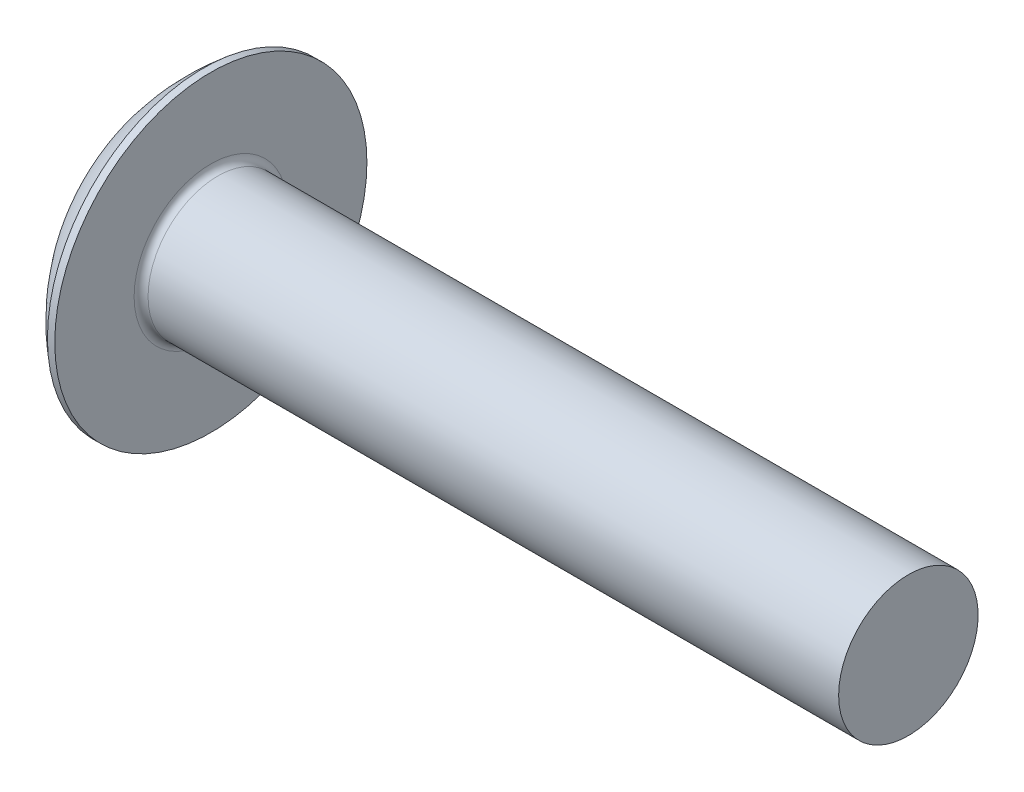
SolidWorks part; units mm, degrees
ref_plane "Front Plane" through (0, 0, 0) normal (0, 0, 1) x (1, 0, 0)
ref_plane "Top Plane" through (0, 0, 0) normal (0, 1, 0) x (1, 0, 0)
ref_plane "Right Plane" through (0, 0, 0) normal (1, 0, 0) x (0, 0, -1)
sketch "BodySke" plane through (0, 0, 0) normal (0, 0, 1) x (1, 0, 0)
  line L0 (0, 0) -> (120.5141, 0) construction
  line L1 (0, 0) -> (0, 50.5629) construction
  line L2 (4.7, 8.95) -> (4.7, 4)
  line L3 (4.7, 4) -> (44.7, 4)
  line L4 (44.7, 4) -> (44.7, 0)
  line L5 (0, 0) -> (44.7, 0)
  line L6 (4.7, 8.95) -> (4.2787, 8.95)
  line L7 (5.95, 10.4217) -> (5.95, -3.1786) construction
  line L8 (7.2, 9.5609) -> (7.2, -6.7938) construction
  arc A0 (0, 0) -> (4.2787, 8.95) centre (11.5, 0) cw
  point P14 (44.7, 3.3095)
  dimension "Head_radius" = 11.5
  dimension "Diameter" = 8
  dimension "Head_height" = 4.7
  dimension "Length" = 40
  dimension "Head_dia" = 17.9
  dimension "Advance" = 1.25
  dimension "Thread_minor" = 6.619
  dimension "Thread_runout" = 2.5
revolve "BaseBody" add sketch "BodySke" angle 360 about L0
fillet "Fillet1" radius 0.4 1 edges at (4.7, 0, 4)
sketch "SlotSke" plane through (0, 0, 0) normal (1, 0, 0) x (0, 0, -1)
  line L1 (8.95, 1.155) -> (-8.95, 1.155)
  line L2 (8.95, 1.155) -> (8.95, -1.155)
  line L3 (8.95, -1.155) -> (-8.95, -1.155)
  line L4 (-8.95, 1.155) -> (-8.95, -1.155)
  dimension "D1" = 17.9
  dimension "D2" = 8.95
  dimension "Slot_width" = 2.31
  dimension "D4" = 1.155
extrude "Slot" cut sketch "SlotSke" along normal blind 2.17
sketch "ThdSchSke" plane through (0, 0, 0) normal (0, 0, 1) x (1, 0, 0)
  line L0 (0, 0) -> (54.7976, 0) construction
  line L1 (44.3013, 4.7973) -> (44.3013, 4)
  line L2 (44.3013, 4.7973) -> (45.0987, 4.7973)
  line L3 (45.0987, 4.7973) -> (45.0987, 4)
  line L4 (45.0987, 4) -> (44.7, 3.3095)
  line L5 (44.7, 3.3095) -> (44.3013, 4)
  line L6 (4.7, 4) -> (44.7, 4) construction
revolve "ThreadSchematic" [suppressed] cut sketch "ThdSchSke" angle 360 about L0
pattern_linear "ThdSchPat" [suppressed] count 31 along (1, 0, 0)
equation "\"Thread_minor@ThreadCosmetic\" = \"Thread_minor@BodySke\""
equation "\"D1@SlotSke\" = \"Head_dia@BodySke\""
equation "\"D2@SlotSke\" = \"D1@SlotSke\" / 2"
equation "\"D4@SlotSke\" = \"Slot_width@SlotSke\" / 2"
equation "\"Advance@ThdSchPat\" = \"Advance@BodySke\""
equation "\"D1@ThdSchPat\" =  int(  ( \"Length@BodySke\" - \"Thread_runout@BodySke\" )  / \"Advance@BodySke\" ) + 1 "
